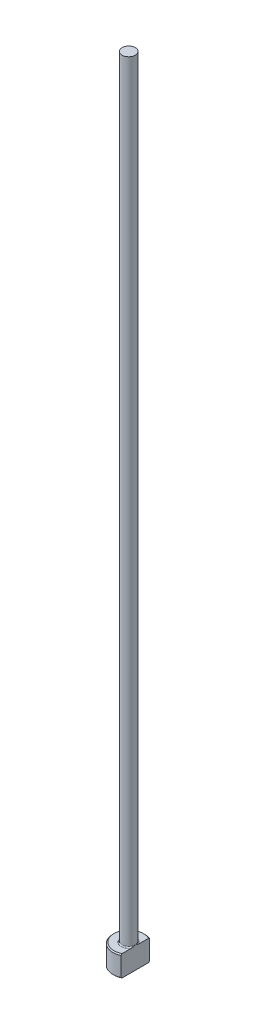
SolidWorks part; units mm, degrees
ref_plane "Front Plane" through (0, 0, 0) normal (0, 0, 1) x (1, 0, 0)
ref_plane "Top Plane" through (0, 0, 0) normal (0, 1, 0) x (1, 0, 0)
ref_plane "Right Plane" through (0, 0, 0) normal (1, 0, 0) x (0, 0, -1)
sketch "Sketch1" plane through (0, 0, 0) normal (0, 0, 1) x (1, 0, 0)
  line L0 (0, 259.9588) -> (0, -15.1925) construction
  line L1 (0, 0) -> (-3, 0)
  line L2 (-3, 0) -> (-3, 4)
  line L3 (-3, 4) -> (-1.25, 4)
  line L4 (-1.25, 4) -> (-1.25, 150)
  line L5 (-1.25, 150) -> (0, 150)
  line L6 (0, 150) -> (0, 0)
  dimension "L" = 150
  dimension "H" = 6
  dimension "T" = 4
  dimension "D" = 2.5
revolve "Revolve1" add sketch "Sketch1" angle 360 about L0
chamfer "Chamfer1" distance 0.2 angle 45 2 edges at (0, 4, 3) (0, 0, 3)
fillet "Fillet1" radius 0.2 1 edges at (0, 4, 1.25)
sketch "Sketch2" plane through (0, 0, 0) normal (0, 1, 0) x (1, 0, 0)
  line L0 (1.25, -2.7272) -> (1.25, 2.7272)
  circle A0 centre (0, 0) radius 3 construction
  arc A1 (1.25, -2.7272) -> (1.25, 2.7272) centre (0, 0) ccw
  circle A2 centre (0, 0) radius 1.25 construction
extrude "KEYED HEAD" cut sketch "Sketch2" along normal through all
